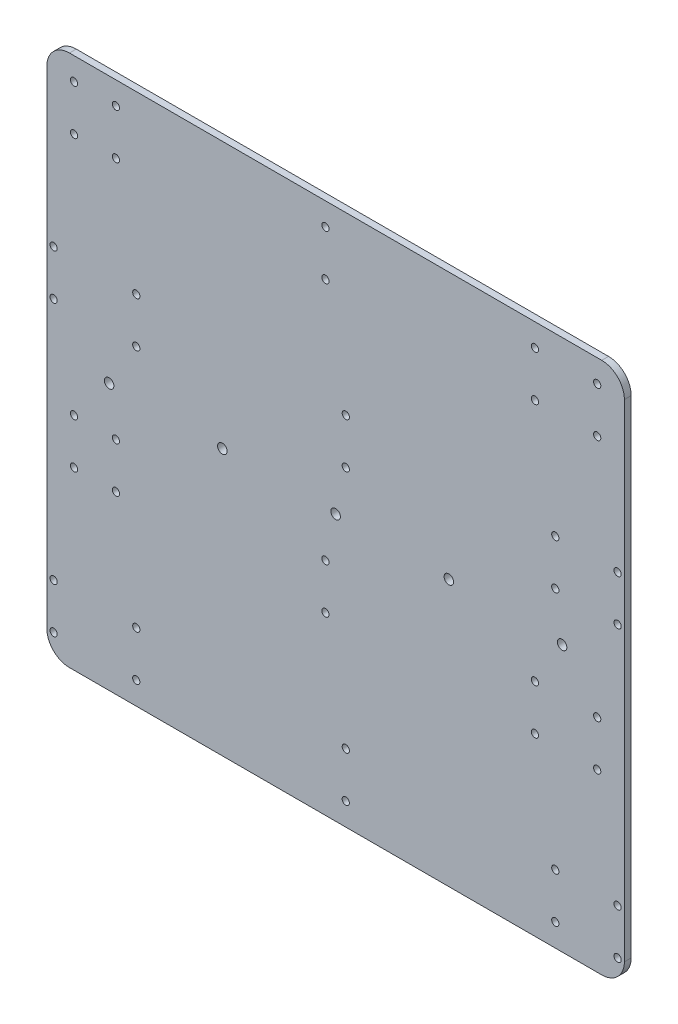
SolidWorks part; units mm, degrees
ref_plane "前视基准面" through (0, 0, 0) normal (0, 0, 1) x (1, 0, 0)
ref_plane "上视基准面" through (0, 0, 0) normal (0, 1, 0) x (1, 0, 0)
ref_plane "右视基准面" through (0, 0, 0) normal (1, 0, 0) x (0, 0, -1)
sketch "草图1" plane through (0, 0, 0) normal (0, 0, 1) x (1, 0, 0)
  line L1 (0, 0) -> (360, 0)
  line L2 (0, 0) -> (0, 275)
  line L3 (0, 275) -> (360, 275)
  line L4 (360, 0) -> (360, 275)
  dimension "D1" = 275
  dimension "D2" = 360
extrude "凸台-拉伸1" add sketch "草图1" along normal blind 3
sketch "草图3" plane through (0, 0, 3) normal (0, 0, 1) x (1, 0, 0)
  line L0 (180, 275) -> (180, 0) construction
  line L1 (360, 275) -> (0, 275) construction
  line L2 (0, 0) -> (360, 0) construction
  line L3 (0, 137.5) -> (360, 137.5) construction
  line L4 (0, 275) -> (0, 0) construction
  line L5 (360, 0) -> (360, 275) construction
  line L6 (300, 275) -> (300, 0) construction
  line L7 (60, 275) -> (60, 0) construction
  line L8 (272.5, 275) -> (272.5, 0) construction
  line L9 (87.5, 275) -> (87.5, 0) construction
  circle A0 centre (175.5, 245) radius 1.6
  circle A1 centre (175.5, 225) radius 1.6
  circle A2 centre (184.5, 177.5) radius 1.6
  circle A3 centre (184.5, 157.5) radius 1.6
  circle A4 centre (184.5, 30) radius 1.6
  circle A5 centre (184.5, 50) radius 1.6
  circle A6 centre (175.5, 97.5) radius 1.6
  circle A7 centre (175.5, 117.5) radius 1.6
  circle A8 centre (295.5, 245) radius 1.6
  circle A9 centre (295.5, 225) radius 1.6
  circle A10 centre (304.5, 177.5) radius 1.6
  circle A11 centre (304.5, 157.5) radius 1.6
  circle A12 centre (304.5, 30) radius 1.6
  circle A13 centre (304.5, 50) radius 1.6
  circle A14 centre (295.5, 97.5) radius 1.6
  circle A15 centre (295.5, 117.5) radius 1.6
  circle A16 centre (64.5, 117.5) radius 1.6
  circle A17 centre (64.5, 97.5) radius 1.6
  circle A18 centre (55.5, 50) radius 1.6
  circle A19 centre (55.5, 30) radius 1.6
  circle A20 centre (55.5, 157.5) radius 1.6
  circle A21 centre (55.5, 177.5) radius 1.6
  circle A22 centre (64.5, 225) radius 1.6
  circle A23 centre (64.5, 245) radius 1.6
  circle A24 centre (268, 245) radius 1.6
  circle A25 centre (268, 225) radius 1.6
  circle A26 centre (277, 177.5) radius 1.6
  circle A27 centre (277, 157.5) radius 1.6
  circle A28 centre (277, 30) radius 1.6
  circle A29 centre (277, 50) radius 1.6
  circle A30 centre (268, 97.5) radius 1.6
  circle A31 centre (268, 117.5) radius 1.6
  circle A32 centre (83, 245) radius 1.6
  circle A33 centre (83, 225) radius 1.6
  circle A34 centre (92, 177.5) radius 1.6
  circle A35 centre (92, 157.5) radius 1.6
  circle A36 centre (92, 30) radius 1.6
  circle A37 centre (92, 50) radius 1.6
  circle A38 centre (83, 97.5) radius 1.6
  circle A39 centre (83, 117.5) radius 1.6
  point P20 (180, 137.5)
  point P32 (180, 137.5)
  point P42 (300, 137.5)
  point P51 (300, 137.5)
  point P68 (60, 137.5)
  point P80 (272.5, 137.5)
  point P89 (272.5, 137.5)
  point P101 (87.5, 137.5)
  point P110 (87.5, 137.5)
  dimension "D1" = 4.5
  dimension "D2" = 4.5
  dimension "D3" = 30
  dimension "D4" = 20
  dimension "D5" = 3.2
  dimension "D6" = 3.2
  dimension "D7" = 20
  dimension "D8" = 20
  dimension "D9" = 3.2
  dimension "D10" = 3.2
  dimension "D11" = 4.5
  dimension "D12" = 4.5
  dimension "D14" = 2
  dimension "D13" = 2
extrude "切除-拉伸1" cut sketch "草图3" against normal blind 3
sketch "草图5" plane through (0, 275, 0) normal (0, 1, 0) x (1, 0, 0)
  line L4 (360, 0) -> (0, 0)
  line L5 (0, 0) -> (0, -3)
  line L6 (0, -3) -> (360, -3)
  line L7 (360, -3) -> (360, 0)
  line L8 (360, 0) -> (0, 0)
  line L9 (0, 0) -> (0, -3)
  line L10 (0, -3) -> (360, -3)
  line L11 (360, -3) -> (360, 0)
  dimension "D1" = 0
extrude "凸台-拉伸2" add sketch "草图5" along normal blind 5
sketch "草图6" plane through (0, 0, 0) normal (0, -1, 0) x (1, 0, 0)
  line L4 (0, 0) -> (360, 0)
  line L5 (360, 0) -> (360, 3)
  line L6 (360, 3) -> (0, 3)
  line L7 (0, 3) -> (0, 0)
  line L8 (0, 0) -> (360, 0)
  line L9 (360, 0) -> (360, 3)
  line L10 (360, 3) -> (0, 3)
  line L11 (0, 3) -> (0, 0)
  dimension "D1" = 0
extrude "凸台-拉伸3" add sketch "草图6" along normal blind 5
sketch "草图7" plane through (0, 0, 3) normal (0, 0, 1) x (1, 0, 0)
  line L1 (0, 280) -> (0, -5) construction
  line L2 (360, -5) -> (0, -5) construction
  line L3 (180, -5) -> (180, 10.3036) construction
  line L4 (0, 137.5) -> (192.631, 137.5) construction
  line L5 (180, 280) -> (180, 264.6964) construction
  line L6 (180, 127.5) -> (180, 142.8036) construction
  circle A0 centre (180, 5) radius 2.1
  circle A1 centre (130, 5) radius 2.1
  circle A2 centre (80, 5) radius 2.1
  circle A3 centre (280, 5) radius 2.1
  circle A4 centre (230, 5) radius 2.1
  circle A5 centre (230, 270) radius 2.1
  circle A6 centre (280, 270) radius 2.1
  circle A7 centre (80, 270) radius 2.1
  circle A8 centre (130, 270) radius 2.1
  circle A9 centre (180, 270) radius 2.1
  circle A10 centre (280, 137.5) radius 2.1
  circle A11 centre (80, 137.5) radius 2.1
  circle A12 centre (230, 137.5) radius 2.1
  circle A13 centre (130, 137.5) radius 2.1
  circle A14 centre (180, 137.5) radius 2.1
  dimension "D1" = 180
  dimension "D2" = 10
  dimension "D3" = 4.2
  dimension "D4" = 3
extrude "切除-拉伸2" cut sketch "草图7" against normal blind 10
sketch "草图8" plane through (0, 0, 3) normal (0, 0, 1) x (1, 0, 0)
  line L1 (52.5, 20) -> (307.5, 20)
  line L2 (52.5, 20) -> (52.5, 255)
  line L3 (52.5, 255) -> (307.5, 255)
  line L4 (307.5, 20) -> (307.5, 255)
  line L5 (52.5, 20) -> (307.5, 255) construction
  line L6 (52.5, 255) -> (307.5, 20) construction
  circle A0 centre (55.5, 177.5) radius 1.6 construction
  point P0 (180, 137.5)
  dimension "D1" = 3
  dimension "D2" = 235
extrude "切除-拉伸3" cut sketch "草图8" against normal blind 10 flip side to cut
fillet "圆角1" radius 10 4 edges at (52.5, 255, 1.5) (307.5, 20, 1.5) (307.5, 255, 1.5) (52.5, 20, 1.5)
